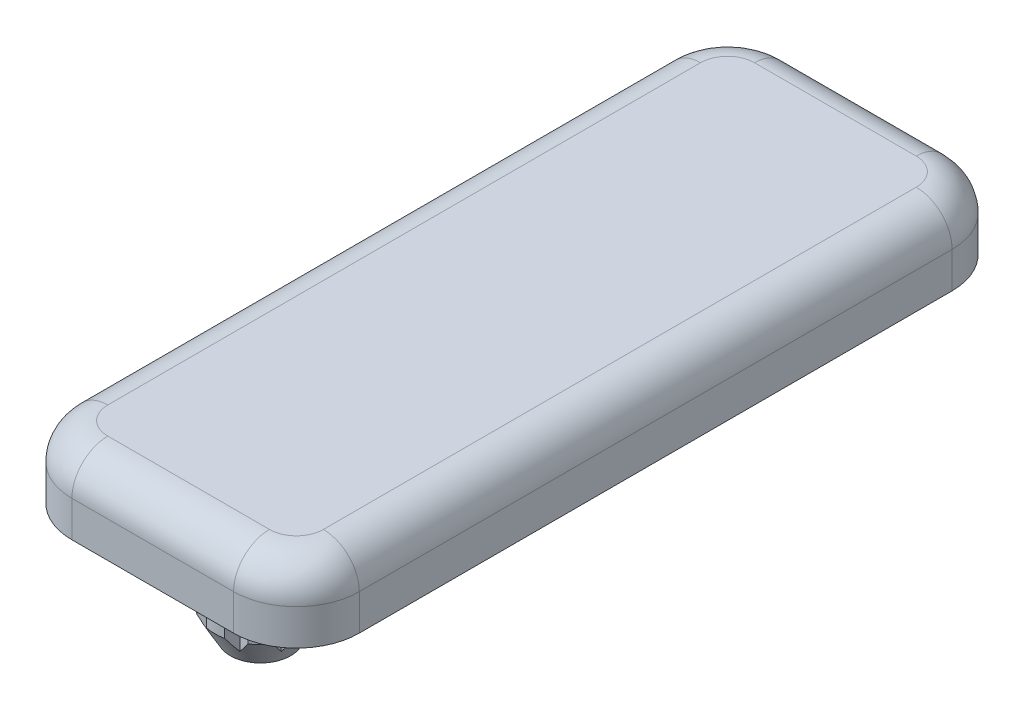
SolidWorks part; units mm, degrees
other "<10008-01-0000-00_abdeckkappe_40x16>-<Verrundung6>"
ref_plane "Ebene vorne" through (0, 0, 0) normal (0, 0, 1) x (1, 0, 0)
ref_plane "Ebene oben" through (0, 0, 0) normal (0, 1, 0) x (1, 0, 0)
ref_plane "Ebene rechts" through (0, 0, 0) normal (1, 0, 0) x (0, 0, -1)
inserted part "10008-01-0000-00_abdeckkappe_40x16"
other "Fläche verschieben1" parameters "D1"=90
